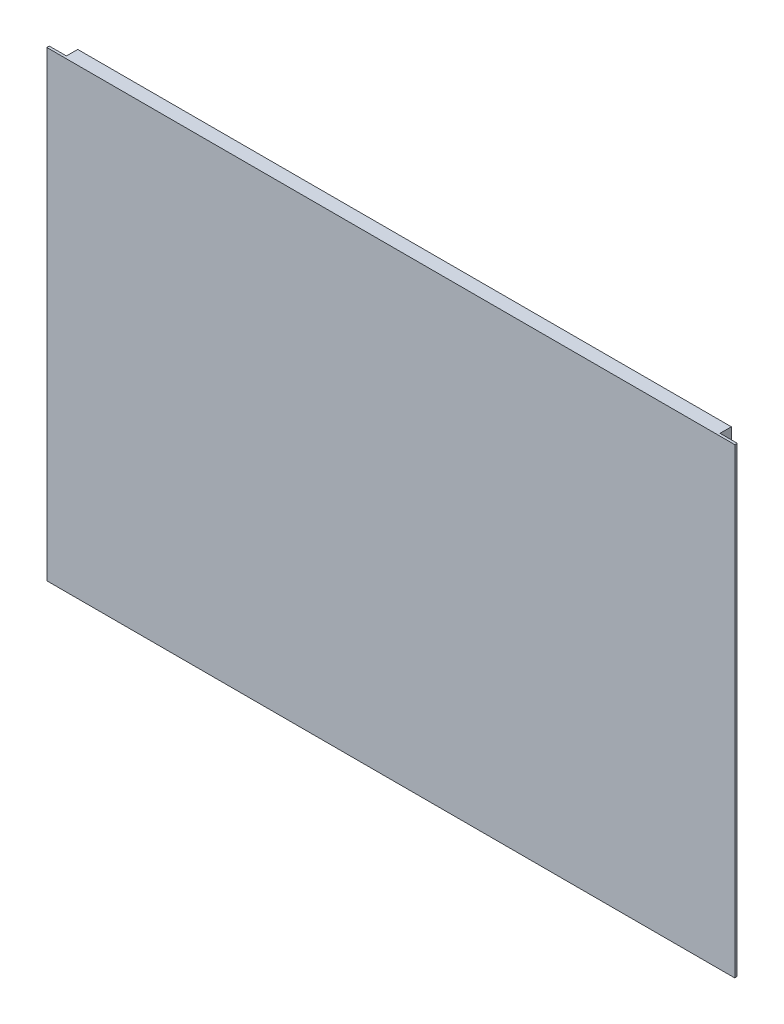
SolidWorks part; units mm, degrees
ref_plane "Ön Düzlem" through (0, 0, 0) normal (0, 0, 1) x (1, 0, 0)
ref_plane "Üst Düzlem" through (0, 0, 0) normal (0, 1, 0) x (1, 0, 0)
ref_plane "Sağ Düzlem" through (0, 0, 0) normal (1, 0, 0) x (0, 0, -1)
sketch "Çizim5" plane through (0, 0, 0) normal (0, 0, 1) x (1, 0, 0)
  line L1 (-78.6957, 40.8696) -> (61.3043, 40.8696)
  line L2 (-78.6957, 40.8696) -> (-78.6957, -53.1304)
  line L3 (-78.6957, -53.1304) -> (61.3043, -53.1304)
  line L4 (61.3043, 40.8696) -> (61.3043, -53.1304)
  dimension "D1" = 140
  dimension "D2" = 94
extrude "Yükseklik-Ekstrüzyon5" add sketch "Çizim5" against normal blind 1
sketch "Çizim7" plane through (-78.6957, 0, 0) normal (-1, 0, 0) x (0, 0, 1)
  line L5 (-1, -53.0304) -> (-3.3, -52.5304)
  line L6 (-1, 40.8696) -> (-1, -53.1304) construction
  line L7 (-3.3, -52.5304) -> (-3.3, -50.0304)
  line L8 (-3.3, -50.0304) -> (-1, -49.5304)
  line L9 (-1, -49.5304) -> (-1, -53.0304)
  line L10 (0, 40.8696) -> (0, -53.1304) construction
  dimension "D1" = 3.3
  dimension "D2" = 2.5
  dimension "D3" = 0.5
  dimension "D4" = 3.5
  dimension "D5" = 0.1
extrude "Yükseklik-Ekstrüzyon6" add sketch "Çizim7" against normal up to surface (140 mm away)
pattern_linear "LÇoğaltma1" count 16 spacing 6 along (0, 1, 0) of "Yükseklik-Ekstrüzyon6"
sketch "Çizim11" plane through (-78.6957, 0, 0) normal (-1, 0, 0) x (0, 0, 1)
  line L0 (0, 40.8696) -> (-3.3, 40.8696)
  line L1 (-3.3, 39.9696) -> (-3.3, 40.8696)
  line L2 (-3.3, 39.9696) -> (0, 39.9696)
  line L3 (0, 40.8696) -> (0, -53.1304) construction
  line L4 (0, 39.9696) -> (0, 40.8696)
extrude "Yükseklik-Ekstrüzyon7" add sketch "Çizim11" against normal up to surface (140 mm away)
sketch "Çizim12" plane through (-78.6957, 0, 0) normal (-1, 0, 0) x (0, 0, 1)
sketch "Çizim13" plane through (-78.6957, 0, 0) normal (-1, 0, 0) x (0, 0, 1)
  line L0 (-1, -53.0304) -> (1.243, -53.4093)
  line L2 (1.243, -53.4093) -> (-0.849, -53.5229)
  line L3 (-0.849, -53.5229) -> (-1, -53.0304)
extrude "Kes-Ekstrüzyon4" cut sketch "Çizim13" against normal up to surface (140 mm away)
sketch "Çizim14" plane through (-78.6957, 0, 0) normal (-1, 0, 0) x (0, 0, 1)
  line L0 (-3.3, 33.9696) -> (-7.4468, 33.9696)
  line L2 (-9.5, 33.4696) -> (-9.5, 32.4696)
  line L3 (-3.3, 31.4696) -> (-3.3, 33.9696)
  spline S0 degree 2 poles (-3.3, 31.4696) (-6.4753, 31.4753) (-9.5, 32.4696) knots 0 0 0 1 1 1
  spline S1 degree 2 poles (-9.5, 33.4696) (-8.5223, 33.9266) (-7.4468, 33.9696) knots 0 0 0 1 1 1
  dimension "D1" = 1
extrude "Yükseklik-Ekstrüzyon8" add sketch "Çizim14" against normal up to surface (140 mm away)
sketch "Çizim15" plane through (0, 33.9696, 0) normal (0, 1, 0) x (1, 0, 0)
  line L0 (-78.6957, 3.3) -> (-74.6957, 3.3)
  line L1 (61.3043, 3.3) -> (-78.6957, 3.3) construction
  line L8 (-78.6957, 9.5) -> (-62.6957, 9.5)
  line L9 (61.3043, 9.5) -> (-78.6957, 9.5) construction
  line L10 (-78.6957, 9.5) -> (-78.6957, 3.3)
  line L13 (61.3043, 2.8) -> (57.3043, 2.8)
  line L14 (61.3043, 9.5) -> (61.3043, 2.8)
  line L15 (61.3043, 9.5) -> (45.3043, 9.5)
  spline S0 degree 2 poles (-74.6957, 3.3) (-69.5753, 8.0052) (-62.6957, 9.5) knots 0 0 0 1 1 1
  spline S1 degree 2 poles (57.3043, 2.8) (52.4996, 8.1646) (45.3043, 9.5) knots 0 0 0 1 1 1
  dimension "D1" = 4
  dimension "D2" = 16
extrude "Kes-Ekstrüzyon7" cut sketch "Çizim15" against normal blind 3
sketch "Çizim17" plane through (0, 0, -3.3) normal (0, 0, -1) x (-1, 0, 0)
  line L0 (-61.3043, 40.8696) -> (-61.3043, -53.1304)
  line L1 (-61.3043, -53.1304) -> (-57.8043, -53.1304)
  line L2 (-61.3043, -53.1304) -> (78.6957, -53.1304) construction
  line L3 (-57.8043, -53.1304) -> (-57.8043, 44.5371)
  line L4 (-57.8043, 44.5371) -> (-61.3043, 44.5371)
  line L5 (-61.3043, 44.5371) -> (-61.3043, 40.8696)
  line L8 (78.6957, 44.5371) -> (78.6957, 40.8696)
  line L9 (75.1957, 44.5371) -> (78.6957, 44.5371)
  line L10 (75.1957, -53.1304) -> (75.1957, 44.5371)
  line L11 (78.6957, -53.1304) -> (75.1957, -53.1304)
  line L12 (78.6957, 40.8696) -> (78.6957, -53.1304)
  dimension "D1" = 3.5
  dimension "D2" = 3.5
  dimension "D3" = 0
extrude "Kes-Ekstrüzyon9" cut sketch "Çizim17" against normal up to surface (2.3 mm away)
sketch "Çizim23" plane through (0, 0, -3.3) normal (0, 0, -1) x (-1, 0, 0)
  line L0 (-51.3043, -35.0304) -> (-31.3043, 16.4696)
  line L1 (-57.8043, -35.0304) -> (75.1957, -35.0304) construction
  line L2 (-57.8043, 16.4696) -> (75.1957, 16.4696) construction
  line L3 (-31.3043, 16.4696) -> (-25.3043, 16.4696)
  line L4 (-25.3043, 16.4696) -> (-45.3043, -35.0304)
  line L5 (-45.3043, -35.0304) -> (-51.3043, -35.0304)
  line L6 (-61.3043, -53.0304) -> (-61.3043, 40.8696) construction
  line L7 (-15.3043, 16.4696) -> (-9.3043, 16.4696)
  line L8 (-35.3043, -35.0304) -> (-15.3043, 16.4696)
  line L9 (-9.3043, 16.4696) -> (-29.3043, -35.0304)
  line L10 (-29.3043, -35.0304) -> (-35.3043, -35.0304)
  line L11 (0.6957, 16.4696) -> (6.6957, 16.4696)
  line L12 (-19.3043, -35.0304) -> (0.6957, 16.4696)
  line L13 (6.6957, 16.4696) -> (-13.3043, -35.0304)
  line L14 (-13.3043, -35.0304) -> (-19.3043, -35.0304)
  line L15 (22.6957, 16.4696) -> (2.6957, -35.0304)
  line L16 (-3.3043, -35.0304) -> (16.6957, 16.4696)
  line L17 (16.6957, 16.4696) -> (22.6957, 16.4696)
  line L18 (-3.3043, -35.0304) -> (2.6957, -35.0304)
  dimension "D1" = 6
  dimension "D2" = 10
  dimension "D3" = 30
  dimension "D4" = 3
  dimension "D5" = 2
extrude "Kes-Ekstrüzyon15" cut sketch "Çizim23" against normal up to surface (2.3 mm away)
sketch "Çizim26" plane through (0, 0, -3.3) normal (0, 0, -1) x (-1, 0, 0)
  line L0 (66.6957, 16.4696) -> (66.6957, -35.0304)
  line L1 (22.6957, 16.4696) -> (75.1957, 16.4696) construction
  line L2 (2.6957, -35.0304) -> (75.1957, -35.0304) construction
  line L3 (66.6957, -35.0304) -> (58.6957, -35.0304)
  line L4 (58.6957, -35.0304) -> (58.6957, 16.4696)
  line L5 (58.6957, 16.4696) -> (66.6957, 16.4696)
  line L6 (78.6957, 40.8696) -> (78.6957, -53.0304) construction
  dimension "D1" = 8
  dimension "D2" = 12
extrude "Kes-Ekstrüzyon16" cut sketch "Çizim26" against normal up to surface (2.3 mm away)
sketch "Çizim28" plane through (0, 0, -3.3) normal (0, 0, -1) x (-1, 0, 0)
  line L0 (12.6957, -35.0304) -> (22.6957, -35.0304)
  line L1 (2.6957, -35.0304) -> (58.6957, -35.0304) construction
  line L2 (38.6957, -35.0304) -> (48.6957, -35.0304)
  line L3 (19.6081, -17.0228) -> (21.4234, -17.0304)
  line L4 (9.6859, -17.0304) -> (58.6957, -17.0304) construction
  line L6 (49.0598, -17.0304) -> (47.2416, -17.0304)
  line L7 (12.6957, -35.0304) -> (19.6081, -17.0228)
  line L8 (22.6957, -35.0304) -> (21.4234, -17.0304)
  line L9 (38.6957, -35.0304) -> (47.2416, -17.0304)
  line L10 (48.6957, -35.0304) -> (49.0598, -17.0304)
  dimension "D1" = 10
  dimension "D2" = 10
  dimension "D3" = 10
  dimension "D4" = 10
extrude "Kes-Ekstrüzyon17" cut sketch "Çizim28" against normal up to surface (2.3 mm away)
sketch "Çizim31" plane through (0, 0, -3.3) normal (0, 0, -1) x (-1, 0, 0)
  line L0 (36.5929, -1.5304) -> (40.3415, -1.5304)
  line L1 (15.7054, -1.5304) -> (58.6957, -1.5304) construction
  line L2 (22.6957, 16.4696) -> (58.6957, 16.4696) construction
  line L4 (32.6957, 16.4696) -> (36.5929, -1.5304)
  line L5 (50.6957, 16.4696) -> (40.3415, -1.5304)
  line L6 (32.6957, 16.4696) -> (50.6957, 16.4696)
extrude "Kes-Ekstrüzyon18" cut sketch "Çizim31" against normal up to surface (2.3 mm away)
sketch "Çizim32" plane through (0, 0, 0) normal (0, 0, 1) x (1, 0, 0)
  line L1 (-78.6957, 40.8696) -> (61.3043, 40.8696)
  line L2 (-78.6957, 40.8696) -> (-78.6957, -53.1304)
  line L3 (-78.6957, -53.1304) -> (61.3043, -53.1304)
  line L4 (61.3043, 40.8696) -> (61.3043, -53.1304)
extrude "Kes-Ekstrüzyon19" cut sketch "Çizim32" against normal blind 0.5
